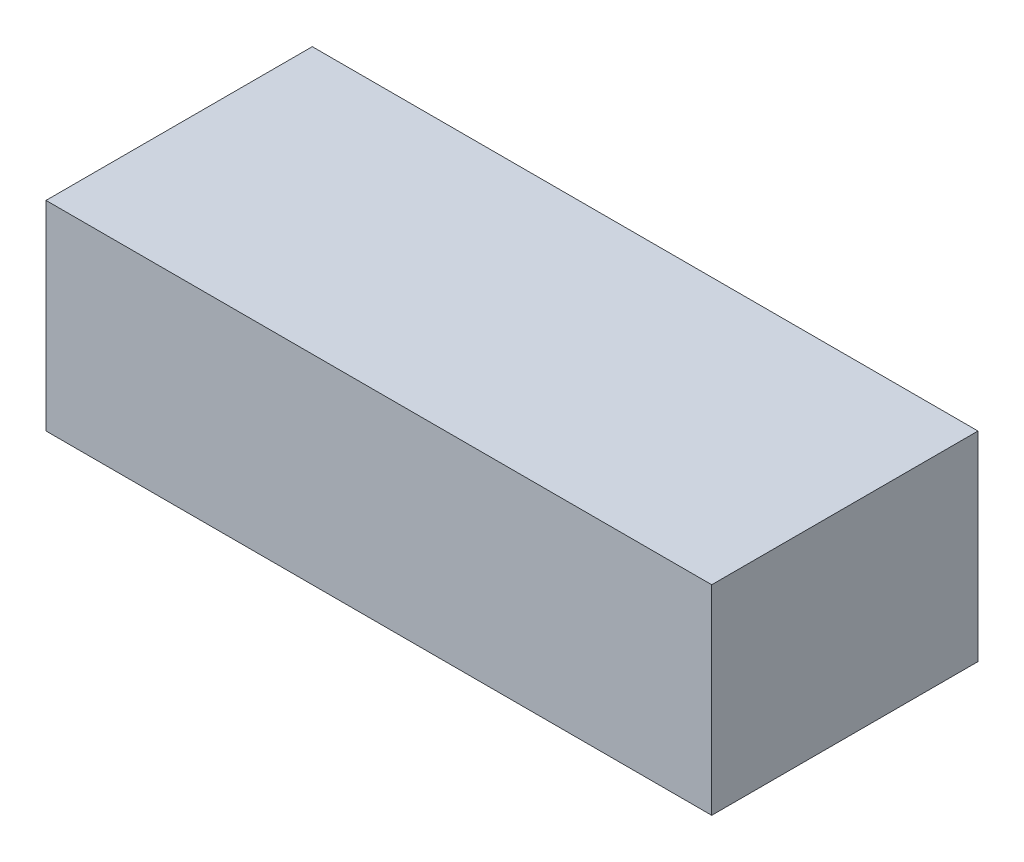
SolidWorks part; units mm, degrees
ref_plane "Vorderseite" through (0, 0, 0) normal (0, 0, 1) x (1, 0, 0)
ref_plane "oben" through (0, 0, 0) normal (0, 1, 0) x (-1, 0, 0)
ref_plane "rechts" through (0, 0, 0) normal (1, 0, 0) x (0, 0, -1)
sketch "Skizze1" plane through (0, 0, 0) normal (0, 0, 1) x (1, 0, 0)
  line L0 (-250, 0) -> (250, 0) construction
  line L1 (-250, -75) -> (250, -75)
  line L2 (-250, -75) -> (-250, 75)
  line L3 (-250, 75) -> (250, 75)
  line L4 (250, -75) -> (250, 75)
  dimension "D1" = 500
  dimension "D2" = 150
extrude "Linear austragen1" add sketch "Skizze1" along normal mid plane 200
sketch "Skizze2" plane through (0, 0, 0) normal (0, 0, 1) x (1, 0, 0)
  line L0 (-250, 75) -> (-250, -75) construction
  line L1 (-250, 10) -> (-270, 10)
  line L2 (-250, 10) -> (-250, -10)
  line L3 (-250, -10) -> (-270, -10)
  line L5 (-270, 0) -> (-250, 0) construction
  arc A0 (-270, 10) -> (-270, -10) centre (-270, 0) ccw
  circle A1 centre (-270, 0) radius 5
  dimension "D2" = 10
  dimension "D1" = 20
  dimension "D3" = 20
extrude "Linear austragen2" add sketch "Skizze2" along normal mid plane 10
